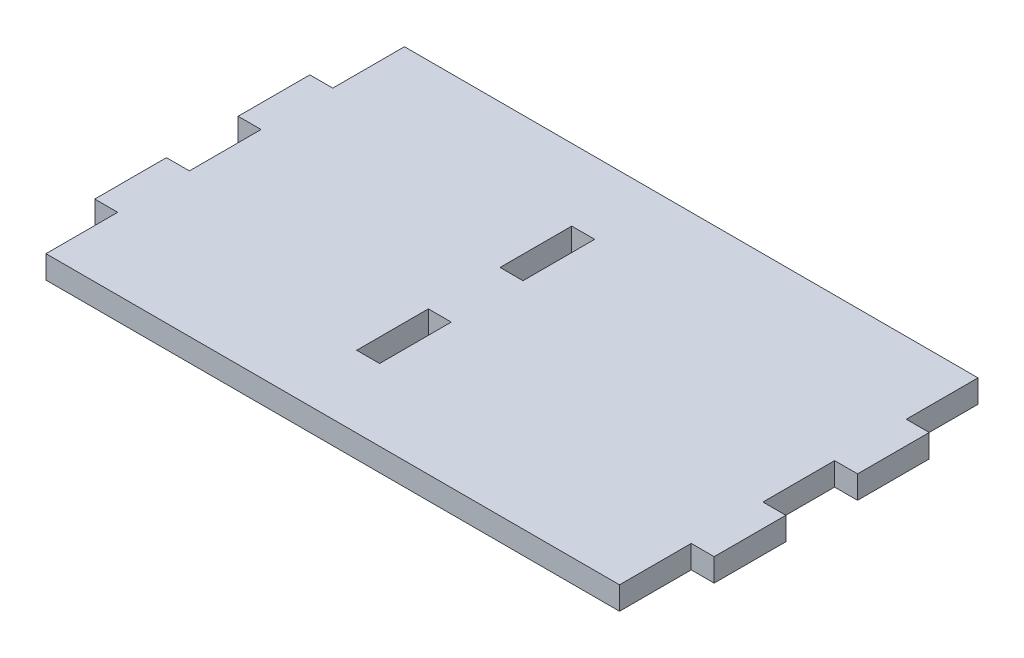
SolidWorks part; units mm, degrees
ref_plane "Alzado" through (0, 0, 0) normal (0, 0, 1) x (1, 0, 0)
ref_plane "Planta" through (0, 0, 0) normal (0, 1, 0) x (1, 0, 0)
ref_plane "Vista lateral" through (0, 0, 0) normal (1, 0, 0) x (0, 0, -1)
sketch "Croquis1" plane through (0, 0, 0) normal (0, 1, 0) x (1, 0, 0)
  line L0 (-162, 18.75) -> (-162, 56.25)
  line L1 (-150, -93.75) -> (150, -93.75)
  line L2 (-150, -93.75) -> (-150, -56.25)
  line L3 (-150, 93.75) -> (150, 93.75)
  line L5 (-150, -93.75) -> (150, 93.75) construction
  line L6 (-150, 93.75) -> (150, -93.75) construction
  line L7 (-150, -56.25) -> (-162, -56.25)
  line L9 (-150, -18.75) -> (-162, -18.75)
  line L10 (-162, -56.25) -> (-162, -18.75)
  line L11 (-150, 56.25) -> (-162, 56.25)
  line L13 (-150, 18.75) -> (-162, 18.75)
  line L18 (0, 93.75) -> (0, 142.0008) construction
  line L31 (-150, 56.25) -> (-150, 93.75)
  line L32 (150, -93.75) -> (150, -56.25)
  line L34 (150, 56.25) -> (150, 93.75)
  line L35 (-150, -18.75) -> (-150, 18.75)
  line L39 (150, -18.75) -> (150, 18.75)
  line L40 (150, 18.75) -> (162, 18.75)
  line L41 (150, 56.25) -> (162, 56.25)
  line L42 (162, -56.25) -> (162, -18.75)
  line L43 (150, -18.75) -> (162, -18.75)
  line L44 (150, -56.25) -> (162, -56.25)
  line L45 (162, 18.75) -> (162, 56.25)
  line L46 (-25, -18.75) -> (-25, -56.25)
  line L47 (-25, 56.25) -> (-13, 56.25)
  line L48 (-25, 56.25) -> (-25, 18.75)
  line L49 (-25, 18.75) -> (-13, 18.75)
  line L50 (-13, 56.25) -> (-13, 18.75)
  line L51 (-25, -56.25) -> (-13, -56.25)
  line L52 (-13, -18.75) -> (-13, -56.25)
  line L53 (-25, -18.75) -> (-13, -18.75)
  point P0 (0, 0)
extrude "Saliente-Extruir1" add sketch "Croquis1" along normal blind 12
equation "\"ancho\"= \"ancho_joint\" * 5"
equation "\"alto\"= 30"
equation "\"material\"= 1.2"
equation "\"ancho_joint_sep\"=3.75"
equation "\"ancho_joint\"=3.75"
equation "\"D4@Croquis1\"=\"ancho_joint\""
equation "\"D5@Croquis1\"=\"material\""
equation "\"D3@Croquis1\"=\"ancho_joint\""
equation "\"D7@Croquis1\"=\"ancho_joint\""
equation "\"D8@Croquis1\"=\"ancho_joint\""
equation "\"D1@Croquis1\"=\"alto\""
equation "\"D2@Croquis1\"=\"ancho_joint\""
equation "\"D9@Croquis1\"=\"material\""
equation "\"D11@Croquis1\"=\"ancho_joint\""
equation "\"D13@Croquis1\"=\"ancho_joint\""
equation "\"D1@Saliente-Extruir1\"=\"material\""
